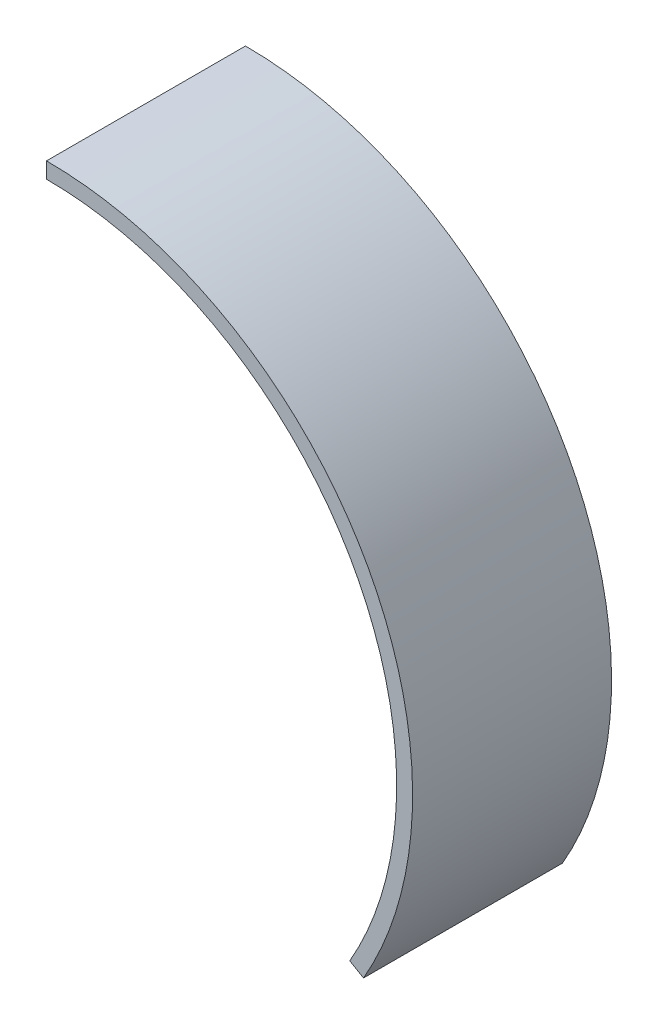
SolidWorks part; units mm, degrees
ref_plane "Plan de face" through (0, 0, 0) normal (0, 0, 1) x (1, 0, 0)
ref_plane "Plan de dessus" through (0, 0, 0) normal (0, 1, 0) x (1, 0, 0)
ref_plane "Plan de droite" through (0, 0, 0) normal (1, 0, 0) x (0, 0, -1)
sketch "Esquisse1" plane through (0, 0, 0) normal (0, 0, 1) x (1, 0, 0)
  line L0 (0, 46) -> (0, 44)
  line L1 (38.1051, -22) -> (39.8372, -23)
  arc A0 (38.1051, -22) -> (0, 44) centre (0, 0) ccw
  arc A1 (39.8372, -23) -> (0, 46) centre (0, 0) ccw
  dimension "D1" = 88
  dimension "D2" = 92
  dimension "D3" = 120
extrude "Extrusion1" add sketch "Esquisse1" along normal blind 25
ref_plane "Plan1" through (19.0526, 11, 0) normal (-0.866, -0.5, 0) x (0, 0, 1)
ref_plane "Plan2" through (39.4042, 22.75, 0) normal (-0.866, -0.5, 0) x (0, 0, 1)
sketch "Esquisse3" plane through (39.4042, 22.75, 0) normal (-0.866, -0.5, 0) x (0, 0, 1)
  line L0 (25, -38.1051) -> (25, 38.1051) construction
  line L1 (25, 39.8372) -> (0, 39.8372) construction
  circle A0 centre (12.5, 0.0022) radius 3.3
  point P2 (25, 0)
  point P5 (12.5, 39.8372)
  dimension "D3" = 6.6
  dimension "D1" = 12.5
  dimension "D2" = 39.835
extrude "Extrusion2" add sketch "Esquisse3" along normal blind 5
